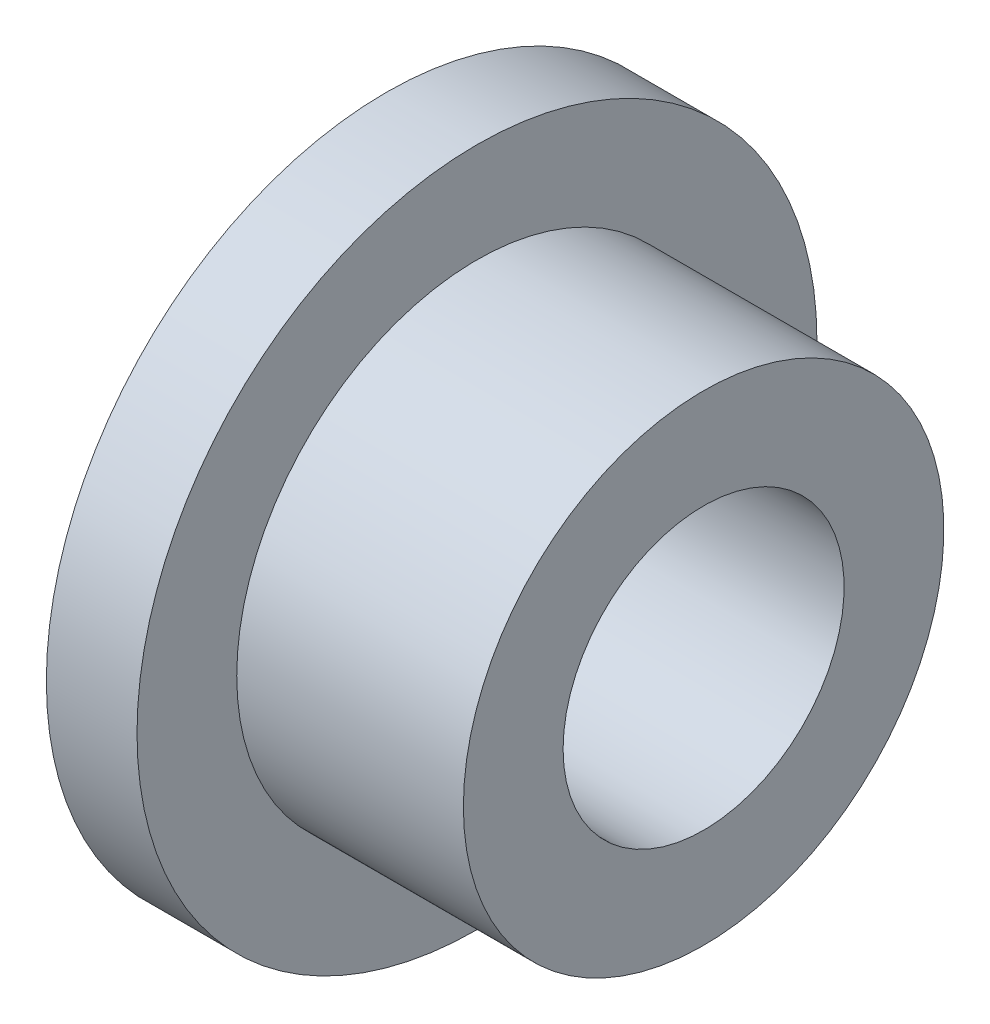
SolidWorks part; units mm, degrees
ref_plane "Plan de face" through (0, 0, 0) normal (0, 0, 1) x (1, 0, 0)
ref_plane "Plan de dessus" through (0, 0, 0) normal (0, 1, 0) x (1, 0, 0)
ref_plane "Plan de droite" through (0, 0, 0) normal (1, 0, 0) x (0, 0, -1)
sketch "Esquisse1" plane through (0, 0, 0) normal (0, 0, 1) x (1, 0, 0)
  line L0 (0, 3.1) -> (0, 7.5)
  line L1 (0, 7.5) -> (2, 7.5)
  line L2 (2, 7.5) -> (2, 5.3)
  line L3 (2, 5.3) -> (7, 5.3)
  line L4 (7, 5.3) -> (7, 3.1)
  line L5 (7, 3.1) -> (0, 3.1)
  line L6 (0, 0) -> (13.8428, 0) construction
  dimension "D1" = 7.5
  dimension "D2" = 2
  dimension "D3" = 3.1
  dimension "D4" = 5.3
  dimension "D5" = 7
revolve "Révolution1" add sketch "Esquisse1" angle 360 about L6
